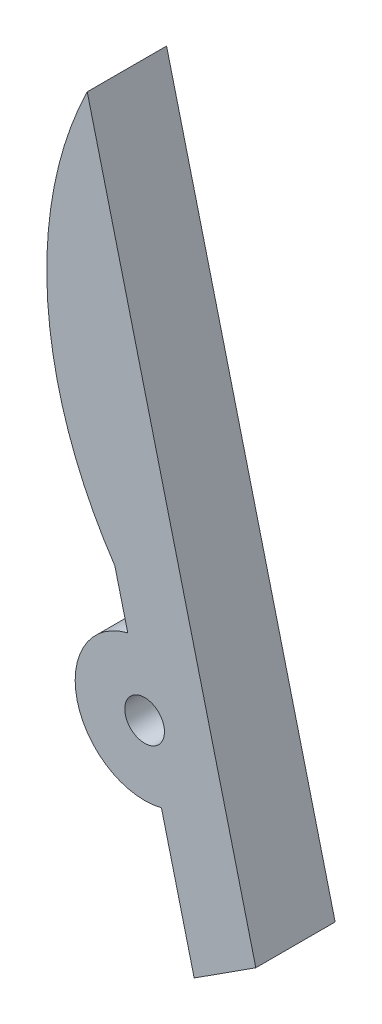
SolidWorks part; units mm, degrees
ref_plane "前视基准面" through (0, 0, 0) normal (0, 0, 1) x (1, 0, 0)
ref_plane "上视基准面" through (0, 0, 0) normal (0, 1, 0) x (1, 0, 0)
ref_plane "右视基准面" through (0, 0, 0) normal (1, 0, 0) x (0, 0, -1)
sketch "草图1" plane through (0, 0, 0) normal (0, 0, 1) x (1, 0, 0)
  line L0 (4.5, 33) -> (2.8489, 39.6045)
  line L1 (1.1511, 46.3955) -> (0.5, 49)
  line L2 (-0.8923, 69) -> (7.6077, 35)
  line L3 (7.6077, 35) -> (4.5, 33)
  arc A0 (1.1511, 46.3955) -> (2.8489, 39.6045) centre (2, 43) ccw
  arc A1 (0.5, 49) -> (-0.8923, 69) centre (17.0686, 60.2019) cw
  circle A2 centre (2, 43) radius 1
  circle A3 centre (2, 43) radius 1 construction
  dimension "D1" = 7
  dimension "D3" = 20
  dimension "D2" = 8
  dimension "D4" = 36
  dimension "D5" = 16
extrude "拉伸1" add sketch "草图1" along normal up to surface (4 mm away)
